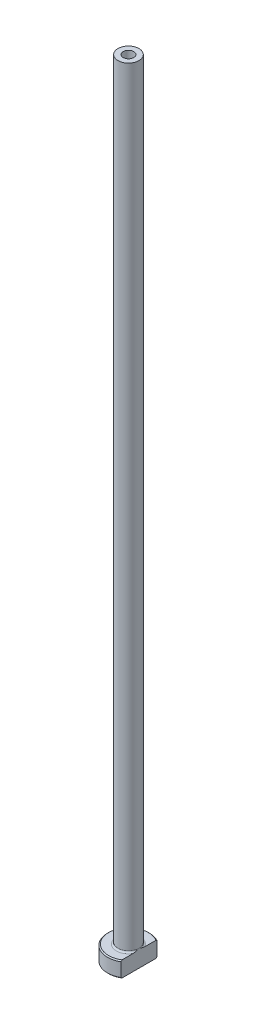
SolidWorks part; units mm, degrees
ref_plane "Front Plane" through (0, 0, 0) normal (0, 0, 1) x (1, 0, 0)
ref_plane "Top Plane" through (0, 0, 0) normal (0, 1, 0) x (1, 0, 0)
ref_plane "Right Plane" through (0, 0, 0) normal (1, 0, 0) x (0, 0, -1)
sketch "Sketch1" plane through (0, 0, 0) normal (0, 0, 1) x (1, 0, 0)
  line L0 (-1, 150) -> (-2, 150)
  line L1 (-2, 150) -> (-2, 3)
  line L2 (-2, 3) -> (-4, 3)
  line L3 (-4, 3) -> (-4, 0)
  line L4 (3.3, 0) -> (-3.3, 0) construction
  line L5 (-4, 0) -> (-1.25, 0)
  line L6 (-1, 115) -> (-1, 150)
  line L7 (0, 92.1877) -> (0, -15.5353) construction
  line L8 (0, -4.4) -> (0, 4.4) construction
  line L9 (-1, 115) -> (-1.25, 103)
  line L10 (-1.25, 103) -> (-1.25, 0)
  dimension "D1" = 0.25
  dimension "ID" = 2
  dimension "OD" = 4
  dimension "L" = 150
  dimension "H" = 8
  dimension "T" = 3
  dimension "N" = 35
  dimension "D2" = 12
  dimension "L-N" = 115
revolve "Revolve1" add sketch "Sketch1" angle 360 about L7
fillet "Fillet1" radius 0.3 1 edges at (0, 3, 2)
chamfer "Chamfer1" distance 0.2 angle 45 2 edges at (0, 3, 4) (0, 0, 4)
sketch "Sketch2" plane through (0, 0, 0) normal (0, -1, 0) x (1, 0, 0)
  line L0 (2, 3.4641) -> (2, -3.4641)
  circle A0 centre (0, 0) radius 4 construction
  arc A1 (2, 3.4641) -> (2, -3.4641) centre (0, 0) cw
  circle A2 centre (0, 0) radius 2 construction
extrude "Cut-Extrude1" cut sketch "Sketch2" against normal through all
chamfer "Chamfer2" distance 0.5 angle 45 1 edges at (0, 0, 1.25)
